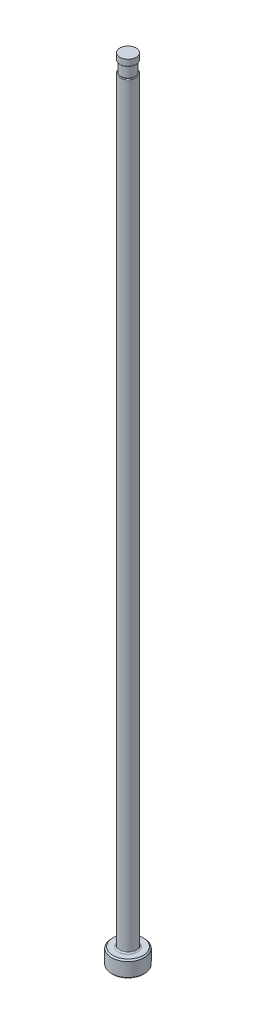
SolidWorks part; units mm, degrees
ref_plane "Front Plane" through (0, 0, 0) normal (0, 0, 1) x (1, 0, 0)
ref_plane "Top Plane" through (0, 0, 0) normal (0, 1, 0) x (1, 0, 0)
ref_plane "Right Plane" through (0, 0, 0) normal (1, 0, 0) x (0, 0, -1)
other "Configuration Table"
sketch "Sketch1" plane through (0, 0, 0) normal (0, 0, 1) x (1, 0, 0)
  line L0 (0, 259.9588) -> (0, -15.1925) construction
  line L1 (0, 0) -> (-3.175, 0)
  line L2 (-3.175, 0) -> (-3.175, 3.175)
  line L3 (-3.175, 3.175) -> (-1.5875, 3.175)
  line L4 (-1.5875, 3.175) -> (-1.5875, 152.4)
  line L5 (-1.5875, 152.4) -> (0, 152.4)
  line L6 (0, 152.4) -> (0, 0)
  dimension "L" = 152.4
  dimension "H" = 6.35
  dimension "T" = 3.175
  dimension "D" = 3.175
revolve "Revolve1" add sketch "Sketch1" angle 360 about L0
chamfer "Chamfer1" distance 0.254 angle 45 2 edges at (0, 3.175, 3.175) (0, 0, 3.175)
fillet "Fillet1" radius 0.254 1 edges at (0, 3.175, 1.5875)
sketch "Sketch2" plane through (0, 0, 0) normal (0, 0, 1) x (1, 0, 0)
  line L0 (-1.5875, 152.4) -> (-1.5875, 3.429) construction
  line L1 (-1.5875, 151.13) -> (-1.3843, 151.13)
  line L2 (-1.5875, 151.13) -> (-1.5875, 149.098)
  line L3 (-1.5875, 149.098) -> (-1.3843, 149.098)
  line L4 (-1.3843, 151.13) -> (-1.3843, 149.098)
  line L5 (1.5875, 152.4) -> (-1.5875, 152.4) construction
  line L6 (0, 153.4483) -> (0, 147.3282) construction
  dimension "D1" = 2.032
  dimension "N" = 1.27
  dimension "FD" = 0.2032
  dimension "D3" = 2.7686
revolve "Vent Relief" cut sketch "Sketch2" angle 360 about L6
sketch "Sketch3" plane through (0, 0, 0) normal (0, 0, 1) x (1, 0, 0)
  line L0 (-1.3843, 150.114) -> (-1.3843, 86.614)
  line L1 (-1.3843, 151.13) -> (-1.3843, 149.098) construction
  line L2 (-1.5875, 149.098) -> (-1.5875, 3.429) construction
  line L3 (-1.5875, 85.4964) -> (-1.5875, 150.114)
  line L4 (-1.5875, 150.114) -> (-1.3843, 150.114)
  arc A0 (-1.3843, 86.614) -> (-1.5875, 85.4964) centre (-4.5593, 86.614) cw
  dimension "D1" = 3.175
  dimension "D2" = 63.5
extrude "D-Slot" cut sketch "Sketch3" against normal through all both and the other way through all
sketch "Sketch5" plane through (0, 0, 0) normal (0, 0, 1) x (1, 0, 0)
  line L0 (-1.5875, 151.13) -> (1.5875, 151.13) construction
  line L1 (-1.5875, 152.4) -> (-1.5684, 152.4)
  line L2 (-1.5875, 152.4) -> (-1.5875, 151.13)
  line L3 (-1.5875, 151.13) -> (-1.5684, 151.13)
  line L4 (-1.5684, 152.4) -> (-1.5684, 151.13)
  line L5 (0, 152.6877) -> (0, 150.5771) construction
  dimension "VP" = 0.019
revolve "Vent Diameter" cut sketch "Sketch5" angle 360 about L5
fillet "Fillet2" radius 0.127 2 edges at (1.5875, 149.098, 0) (0, 151.13, 1.5684)
sketch "Pocket Sketch" plane through (0, 0, 0) normal (0, 0, 1) x (1, 0, 0)
  line L0 (-3.5719, 0) -> (-3.5719, 3.2004)
  line L1 (-3.5719, 3.2004) -> (-2.5479, 3.2004)
  line L2 (-1.7859, 3.9624) -> (-1.7859, 22.225)
  line L3 (-1.7859, 22.225) -> (0, 22.225)
  line L4 (0, 22.225) -> (0, 0)
  line L5 (0, 0) -> (-3.5719, 0)
  line L6 (0, 12.6104) -> (0, -2.4989) construction
  line L7 (-3.175, 2.921) -> (-3.175, 0.254) construction
  line L8 (2.921, 3.175) -> (-2.921, 3.175) construction
  line L9 (-1.5875, 85.4964) -> (-1.5875, 3.429) construction
  line L10 (-2.5479, 3.2004) -> (-1.7859, 3.9624)
  point P3 (-1.7859, 3.2004)
  dimension "D1" = 7.1437
  dimension "D2" = 0.3969
  dimension "D3" = 0.0254
  dimension "D4" = 0.1984
  dimension "D5" = 3.5719
  dimension "D6" = 22.225
